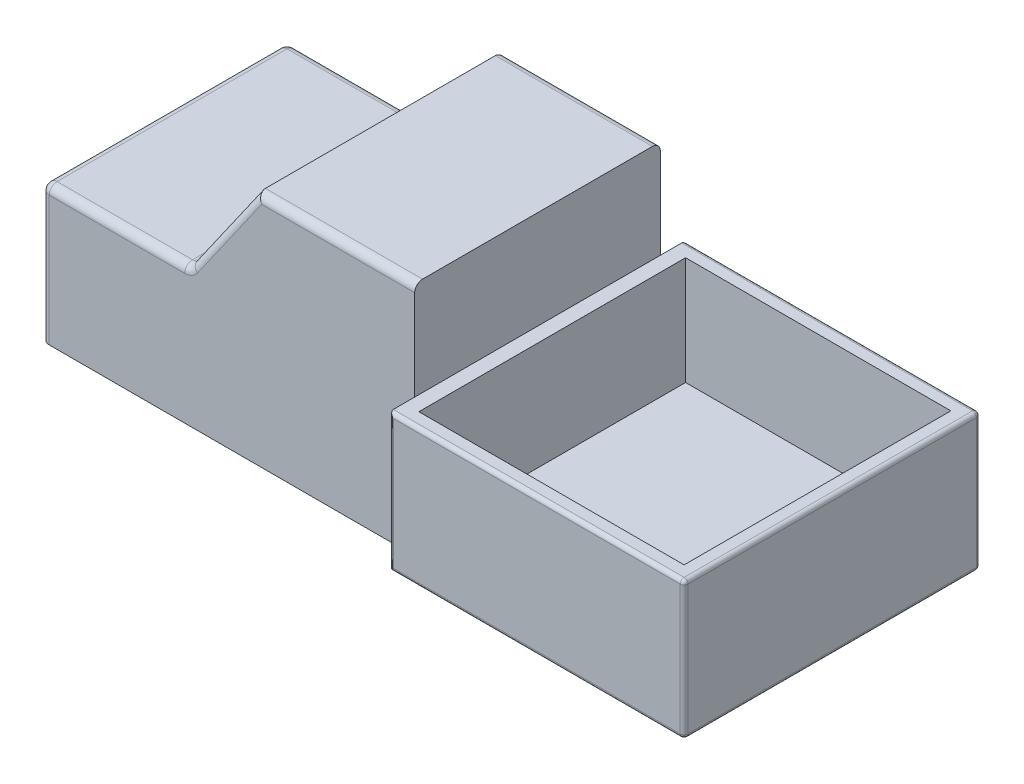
SolidWorks part; units mm, degrees
ref_plane "Front Plane" through (0, 0, 0) normal (0, 0, 1) x (1, 0, 0)
ref_plane "Top Plane" through (0, 0, 0) normal (0, 1, 0) x (1, 0, 0)
ref_plane "Right Plane" through (0, 0, 0) normal (1, 0, 0) x (0, 0, -1)
sketch "Sketch1" plane through (0, 0, 0) normal (0, 0, 1) x (1, 0, 0)
  line L0 (-406.4, 88.9) -> (-406.4, -88.9)
  line L1 (-406.4, -88.9) -> (406.4, -88.9)
  line L2 (406.4, -88.9) -> (406.4, 88.9)
  line L3 (406.4, 88.9) -> (76.2, 88.9)
  line L4 (76.2, 88.9) -> (76.2, 215.9)
  line L5 (76.2, 215.9) -> (-126.9736, 215.9)
  line L6 (-126.9736, 215.9) -> (-215.9, 88.9)
  line L7 (-215.9, 88.9) -> (-406.4, 88.9)
  line L8 (-406.4, 88.9) -> (406.4, -88.9) construction
  line L9 (-406.4, -88.9) -> (406.4, 88.9) construction
  dimension "D1" = 812.8
  dimension "D2" = 190.5
  dimension "D3" = 177.8
  dimension "D4" = 177.8
  dimension "D5" = 330.2
  dimension "D6" = 127
  dimension "D7" = 55
extrude "Boss-Extrude1" add sketch "Sketch1" along normal mid plane 317.5
sketch "Sketch3" plane through (0, -88.9, 0) normal (0, -1, 0) x (1, 0, 0)
  circle A0 centre (0, 0) radius 20
sketch "Sketch6" plane through (0, 0, 158.75) normal (0, 0, 1) x (1, 0, 0)
  line L0 (76.2, 88.9) -> (406.4, 88.9)
  line L1 (406.4, 88.9) -> (406.4, -88.9)
  line L2 (406.4, -88.9) -> (76.2, -88.9)
  line L3 (-406.4, -88.9) -> (406.4, -88.9) construction
  line L4 (76.2, -88.9) -> (76.2, 88.9)
extrude "Boss-Extrude3" add sketch "Sketch6" along normal blind 32.7
mirror "Mirror2" about plane through (0, 0, 0) normal (0, 0, 1) of "Boss-Extrude3"
fillet "Fillet4" radius 10.16 10 edges at (-171.4368, 152.4, 158.75) (-171.4368, 152.4, -158.75) (-215.9, 88.9, 0) (-311.15, 88.9, 158.75) (-406.4, 88.9, 0) (-311.15, 88.9, -158.75) (-25.3868, 215.9, -158.75) (-25.3868, 215.9, 158.75) (-406.4, 0, -158.75) (-406.4, 0, 158.75)
sketch "Sketch10" plane through (406.4, 0, 0) normal (1, 0, 0) x (0, 0, -1)
  line L1 (-191.45, 88.9) -> (191.45, 88.9)
  line L2 (-191.45, 88.9) -> (-191.45, -88.9)
  line L3 (-191.45, -88.9) -> (191.45, -88.9)
  line L4 (191.45, 88.9) -> (191.45, -88.9)
extrude "Boss-Extrude5" add sketch "Sketch10" along normal blind 50.8
sketch "Sketch11" plane through (0, 88.9, 0) normal (0, 1, 0) x (1, 0, 0)
  line L0 (95.25, 172.4) -> (95.25, -172.4)
  line L1 (95.25, 172.4) -> (438.15, 172.4)
  line L2 (95.25, -172.4) -> (438.15, -172.4)
  line L3 (438.15, 172.4) -> (438.15, -172.4)
  line L4 (457.2, 191.45) -> (76.2, 191.45) construction
  line L5 (76.2, -148.59) -> (76.2, 148.59) construction
  line L6 (457.2, 191.45) -> (457.2, -191.45) construction
  line L7 (457.2, -191.45) -> (76.2, -191.45) construction
extrude "Cut-Extrude2" cut sketch "Sketch11" against normal blind 139.7
fillet "Fillet13" radius 5.08 10 edges at (266.7, 88.9, 191.45) (266.7, -88.9, 191.45) (76.2, 0, 191.45) (457.2, 88.9, 0) (457.2, -88.9, 0) (457.2, 0, 191.45) (266.7, -88.9, -191.45) (457.2, 0, -191.45) (266.7, 88.9, -191.45) (76.2, 0, -191.45)
sketch "Sketch12" plane through (0, -50.8, 0) normal (0, 1, 0) x (1, 0, 0)
  line L0 (266.7, 172.4) -> (266.7, -172.4) construction
  line L1 (438.15, 172.4) -> (95.25, 172.4) construction
  line L2 (95.25, -172.4) -> (438.15, -172.4) construction
  line L3 (359.41, 172.4) -> (359.41, -172.4) construction
  line L4 (95.25, -93.66) -> (438.15, -93.66) construction
  line L5 (95.25, 172.4) -> (95.25, -172.4) construction
  line L6 (438.15, -172.4) -> (438.15, 172.4) construction
  circle A3 centre (266.7, -93.66) radius 76.2
  point P7 (0, 0)
  point P8 (0, 0)
  point P19 (0, 0)
  dimension "D6" = 152.4
  dimension "D4" = 78.74
  dimension "D5" = 78.74
sketch "Sketch13" plane through (0, -50.8, 0) normal (0, 1, 0) x (1, 0, 0)
  line L3 (438.15, -172.4) -> (438.15, 172.4) construction
  line L4 (95.25, 80.325) -> (438.15, 80.325) construction
  line L5 (95.25, 172.4) -> (95.25, -172.4) construction
  line L6 (438.15, 172.4) -> (95.25, 172.4) construction
  line L9 (97.79, 172.4) -> (435.61, 172.4)
  line L10 (97.79, 172.4) -> (97.79, -11.75)
  line L11 (97.79, -11.75) -> (435.61, -11.75)
  line L12 (435.61, 172.4) -> (435.61, -11.75)
  line L13 (97.79, 172.4) -> (435.61, -11.75) construction
  line L14 (97.79, -11.75) -> (435.61, 172.4) construction
  point P1 (266.7, 80.325)
  dimension "D1" = 337.82
  dimension "D2" = 92.075
equation "\"D3@Sketch11\"=\"D2@Sketch11\""
equation "\"D4@Sketch11\"=\"D1@Sketch11\""
